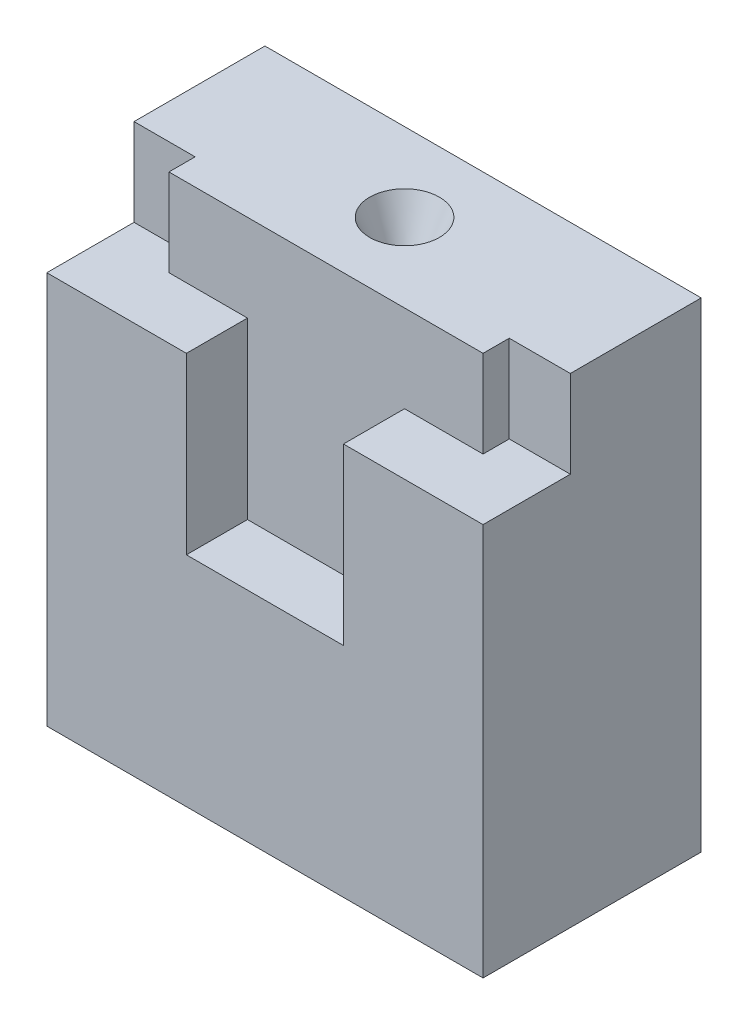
SolidWorks part; units mm, degrees
ref_plane "前视基准面" through (0, 0, 0) normal (0, 0, 1) x (1, 0, 0)
ref_plane "上视基准面" through (0, 0, 0) normal (0, 1, 0) x (1, 0, 0)
ref_plane "右视基准面" through (0, 0, 0) normal (1, 0, 0) x (0, 0, -1)
sketch "草图1" plane through (0, 0, 0) normal (0, 1, 0) x (1, 0, 0)
  line L0 (0, 0) -> (80.8939, 0) construction
  line L1 (80.8939, 0) -> (0, 0) construction
  line L2 (0, 0) -> (0, 69.8629) construction
  line L4 (-25, 12.5) -> (25, 12.5)
  line L5 (-25, 12.5) -> (-25, -12.5)
  line L6 (-25, -12.5) -> (25, -12.5)
  line L7 (25, 12.5) -> (25, -12.5)
extrude "拉伸1" add sketch "草图1" along normal blind 55
sketch "草图3" plane through (0, 55, 0) normal (0, 1, 0) x (1, 0, 0)
  line L0 (0, 0) -> (0, -17.4808) construction
  line L1 (-25, -12.5) -> (25, -12.5) construction
  line L2 (-9, -5.5) -> (9, -5.5)
  line L3 (-9, -5.5) -> (-9, -12.5)
  line L4 (-9, -12.5) -> (9, -12.5)
  line L5 (9, -5.5) -> (9, -12.5)
extrude "切除-拉伸2" cut sketch "草图3" against normal blind 30
sketch "草图4" plane through (0, 55, 0) normal (0, 1, 0) x (1, 0, 0)
  line L0 (-9, -5.5) -> (-18, -5.5)
  line L2 (-18, -5.5) -> (-18, -2.5)
  line L3 (-18, -2.5) -> (-25, -2.5)
  line L4 (-25, 12.5) -> (-25, -12.5) construction
  line L5 (-25, -2.5) -> (-25, -12.5)
  line L6 (-25, -12.5) -> (-9, -12.5)
  line L7 (-9, -12.5) -> (-9, -5.5)
  line L8 (0, 0) -> (0, -17.9598) construction
  line L9 (9, -12.5) -> (9, -5.5)
  line L10 (25, -12.5) -> (9, -12.5)
  line L11 (25, -2.5) -> (25, -12.5)
  line L12 (18, -2.5) -> (25, -2.5)
  line L13 (18, -5.5) -> (18, -2.5)
  line L14 (9, -5.5) -> (18, -5.5)
extrude "切除-拉伸3" cut sketch "草图4" against normal blind 10
sketch "草图5" plane through (0, 0, 0) normal (1, 0, 0) x (0, 0, -1)
  line L0 (3.5, 4.0927) -> (3.5, 59.0885) construction
  line L1 (-12.5, 25) -> (-12.5, 45) construction
  line L2 (3.5, 55) -> (-0.5, 55)
  line L3 (-2.5, 55) -> (12.5, 55) construction
  line L4 (-0.5, 55) -> (3.5, 45.5594)
  line L5 (3.5, 45.5594) -> (3.5, 55)
  dimension "D1" = 16
revolve "切除-旋转1" cut sketch "草图5" angle 360 about L0
